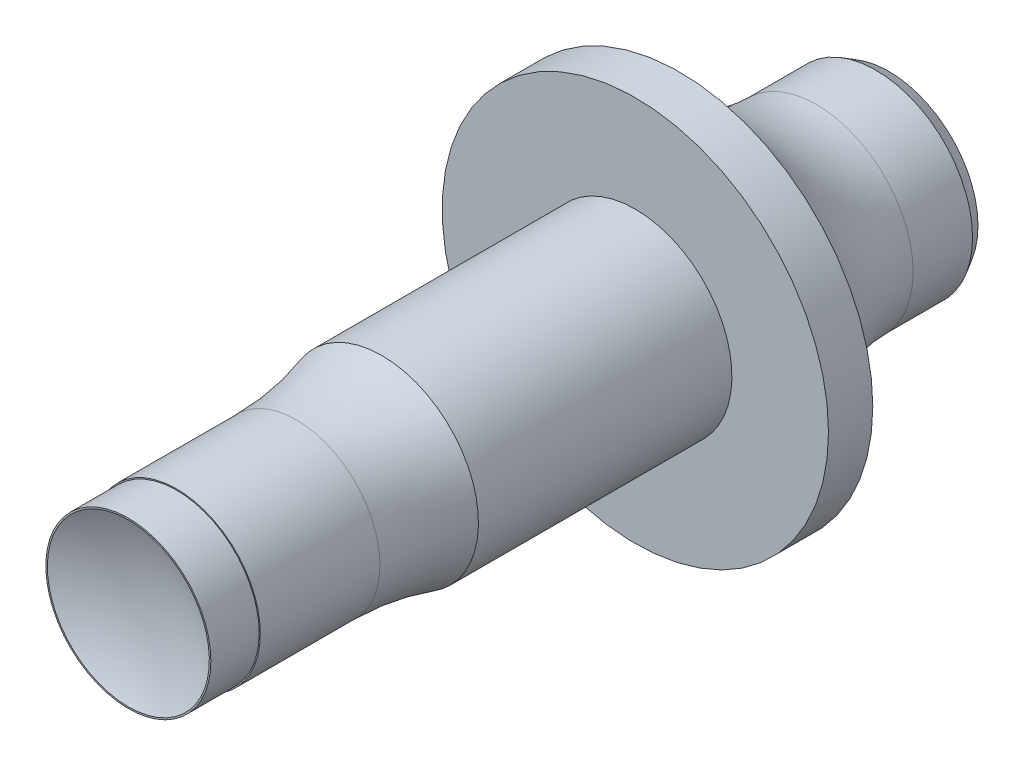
SolidWorks part; units mm, degrees
ref_plane "Front Plane" through (0, 0, 0) normal (0, 0, 1) x (1, 0, 0)
ref_plane "Top Plane" through (0, 0, 0) normal (0, 1, 0) x (1, 0, 0)
ref_plane "Right Plane" through (0, 0, 0) normal (1, 0, 0) x (0, 0, -1)
sketch "Sketch1" plane through (0, 0, 0) normal (0, 0, 1) x (1, 0, 0)
  circle A0 centre (0, 0) radius 12.7
  dimension "D1" = 25.4
extrude "Boss-Extrude1" add sketch "Sketch1" against normal blind 100
sketch "Sketch2" plane through (0, 0, 0) normal (0, 0, 1) x (1, 0, 0)
  circle A0 centre (0, 0) radius 11
  dimension "D1" = 22
extrude "Cut-Extrude1" cut sketch "Sketch2" against normal blind 33.3333 flip side to cut
sketch "Sketch3" plane through (0, 0, 0) normal (0, 0, 1) x (1, 0, 0)
  circle A0 centre (0, 0) radius 10.85
  dimension "D1" = 21.7
extrude "Cut-Extrude2" cut sketch "Sketch3" against normal blind 6.35 flip side to cut
sketch "Sketch4" plane through (0, 0, 0) normal (1, 0, 0) x (0, 0, -1)
  line L0 (0, 0) -> (0, 10.65)
  line L1 (0, 10.85) -> (0, -10.85) construction
  line L2 (2.3406, 0) -> (2.3406, 10.65) construction
  line L3 (0, 0) -> (2.3406, 0)
  line L4 (0, 0) -> (0, -10.65) construction
  arc A0 (2.3406, 0) -> (0, 10.65) centre (-23.0594, 0) ccw
  dimension "D2" = 25.4
  dimension "D1" = 21.3
revolve "Cut-Revolve1" cut sketch "Sketch4" angle 360 about L3
chamfer "Chamfer1" distance 1.6933 angle 30 1 edges at (12.7, 0, -100)
sketch "Sketch5" plane through (0, 0, 0) normal (1, 0, 0) x (0, 0, -1)
  line L0 (33.3333, 0) -> (22.0794, 0)
  line L1 (33.3333, 12.7) -> (33.3333, -12.7) construction
  line L2 (22.0794, 0) -> (22.0794, 11)
  line L3 (33.3333, 11) -> (6.35, 11) construction
  line L4 (33.3333, 12.7) -> (33.3333, 0)
  line L5 (22.0794, 11) -> (33.3333, 11) construction
  arc A0 (22.0794, 11) -> (33.3333, 12.7) centre (22.0794, 49.1) ccw
  dimension "D1" = 38.1
revolve "Revolve1" add sketch "Sketch5" angle 360 about L0
sketch "Sketch6" plane through (0, 0, 0) normal (1, 0, 0) x (0, 0, -1)
  line L0 (66.6667, 0) -> (90.4867, 0)
  line L1 (66.6667, 0) -> (66.6667, 25.4)
  line L2 (66.6667, 25.4) -> (72.4908, 25.4)
  line L3 (90.4867, 0) -> (90.4867, 12.7)
  line L4 (98.3067, 12.7) -> (33.3333, 12.7) construction
  line L5 (90.4867, 12.7) -> (66.6667, 12.7) construction
  line L6 (100, -12.7) -> (100, 12.7) construction
  arc A0 (90.4867, 12.7) -> (72.4908, 25.4) centre (90.4867, 31.8) cw
  dimension "D2" = 19.1
  dimension "D1" = 33.3333
  dimension "D3" = 23.82
revolve "Revolve2" add sketch "Sketch6" angle 360 about L0
sketch "Sketch7" plane through (0, 0, -100) normal (0, 0, -1) x (-1, 0, 0)
  line L9 (-21.4951, 4.8864) -> (-11.7224, 4.8864)
  line L10 (-21.4951, 4.8864) -> (-21.4951, -4.8864)
  line L11 (-21.4951, -4.8864) -> (-11.7224, -4.8864)
  line L12 (-11.7224, 4.8864) -> (-11.7224, -4.8864)
  circle A5 centre (0, 0) radius 12.7 construction
  circle A6 centre (0, 0) radius 11.7224 construction
  point P8 (-11.7224, 0)
extrude "Cut-Extrude3" [suppressed] cut sketch "Sketch7" against normal through all
